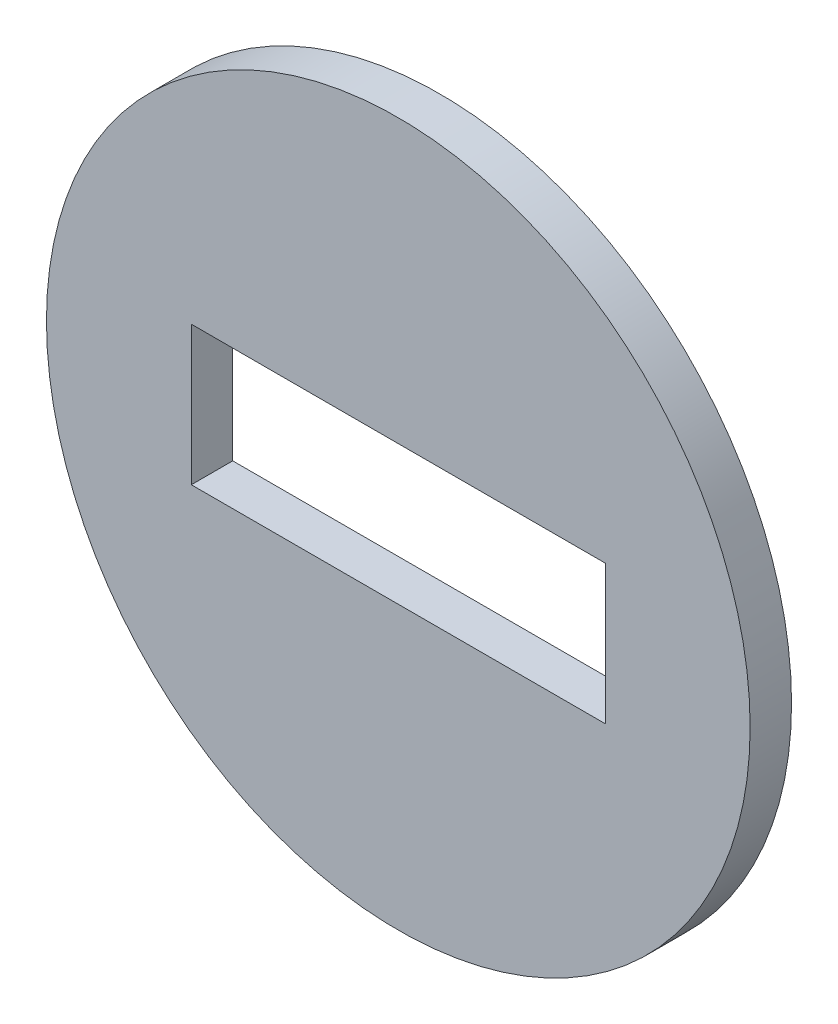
SolidWorks part; units mm, degrees
ref_plane "Front Plane" through (0, 0, 0) normal (0, 0, 1) x (1, 0, 0)
ref_plane "Top Plane" through (0, 0, 0) normal (0, 1, 0) x (1, 0, 0)
ref_plane "Right Plane" through (0, 0, 0) normal (1, 0, 0) x (0, 0, -1)
sketch "Sketch1" plane through (0, 0, 0) normal (0, 0, 1) x (1, 0, 0)
  circle A0 centre (0, 0) radius 26.9875
  dimension "D1" = 53.975
extrude "Extrude1" add sketch "Sketch1" along normal blind 3.175
sketch "Sketch2" plane through (0, 0, 3.175) normal (0, 0, 1) x (1, 0, 0)
  line L1 (-15.875, 5.334) -> (15.875, 5.334)
  line L2 (-15.875, 5.334) -> (-15.875, -5.334)
  line L3 (-15.875, -5.334) -> (15.875, -5.334)
  line L4 (15.875, 5.334) -> (15.875, -5.334)
  dimension "D1" = 31.75
  dimension "D2" = 15.875
  dimension "D3" = 10.668
  dimension "D4" = 5.334
extrude "Cut-Extrude1" cut sketch "Sketch2" against normal through all
